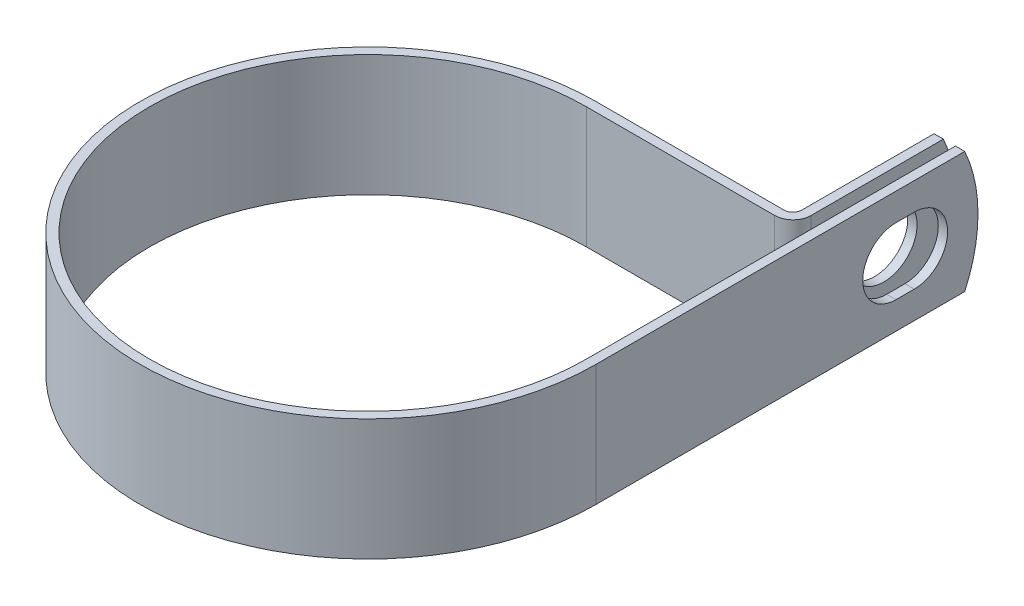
SolidWorks part; units mm, degrees
ref_plane "Front Plane" through (0, 0, 0) normal (0, 0, 1) x (1, 0, 0)
ref_plane "Top Plane" through (0, 0, 0) normal (0, 1, 0) x (1, 0, 0)
ref_plane "Right Plane" through (0, 0, 0) normal (1, 0, 0) x (0, 0, -1)
sketch "Sketch1" plane through (0, 0, 0) normal (0, 1, 0) x (1, 0, 0)
  line L0 (0, 28.575) -> (24.6228, 28.575)
  line L1 (28.575, 0) -> (28.575, 28.575)
  line L2 (27.0002, 49.9872) -> (27.0002, 30.9524)
  line L5 (28.575, 28.575) -> (28.575, 49.9872)
  arc A0 (0, 28.575) -> (28.575, 0) centre (0, 0) ccw
  arc A3 (24.6228, 28.575) -> (27.0002, 30.9524) centre (24.6228, 30.9524) ccw
extrude "Extrude-Thin1" add sketch "Sketch1" along normal mid plane 15.875 thin
sketch "Sketch2" plane through (25.781, 0, 0) normal (-1, 0, 0) x (0, 0, 1)
  line L0 (-49.9872, 7.9375) -> (-49.9872, -7.9375) construction
  line L7 (0, 7.9375) -> (0, -7.9375) construction
  circle A0 centre (-40.4622, 0) radius 4.3561
  point P2 (-49.9872, 0)
extrude "Cut-Extrude1" cut sketch "Sketch2" against normal up to surface (1.2192 mm away)
sketch "Sketch3" plane through (29.7942, 0, 0) normal (1, 0, 0) x (0, 0, -1)
  line L0 (39.2684, 0) -> (41.656, 0) construction
  line L1 (39.2684, 4.3561) -> (41.656, 4.3561)
  line L2 (39.2684, -4.3561) -> (41.656, -4.3561)
  line L3 (49.9872, 7.9375) -> (49.9872, -7.9375) construction
  arc A0 (39.2684, 4.3561) -> (39.2684, -4.3561) centre (39.2684, 0) ccw
  arc A1 (41.656, -4.3561) -> (41.656, 4.3561) centre (41.656, 0) ccw
  point P3 (40.4622, 0)
  point P8 (49.9872, 0)
  point P11 (34.9123, 0)
  point P12 (46.0121, 0)
extrude "Cut-Extrude2" cut sketch "Sketch3" against normal up to surface (1.2192 mm away)
sketch "Sketch4" plane through (25.781, 0, 0) normal (-1, 0, 0) x (0, 0, 1)
  line L0 (-49.9872, 7.9375) -> (-49.9872, -7.9375)
  line L1 (-49.9872, 7.9375) -> (-48.2548, 7.9375)
  line L2 (-49.9872, 7.9375) -> (-30.9524, 7.9375) construction
  line L3 (-49.9872, -7.9375) -> (-48.2548, -7.9375)
  line L4 (-49.9872, -7.9375) -> (-30.9524, -7.9375) construction
  arc A0 (-48.2548, 7.9375) -> (-48.2548, -7.9375) centre (-30.9372, 0) ccw
extrude "Cut-Extrude3" cut sketch "Sketch4" against normal through all contours A0 M4 M5 | A0 L0 M2
equation "\"D1@Sketch3\" = \"D2@Sketch2\""
equation "\"D7@Sketch1\" = \"D3@Sketch2\" + \"D1@Sketch3\""
equation "\"D1@Sketch4\" = ( \"D1@Extrude-Thin1\" + .125 ) * 2"
equation "\"D2@Sketch1\"=1.95*\"D5@Extrude-Thin1\""
equation "\"D2@Sketch3\" = \"D1@Sketch2\""
